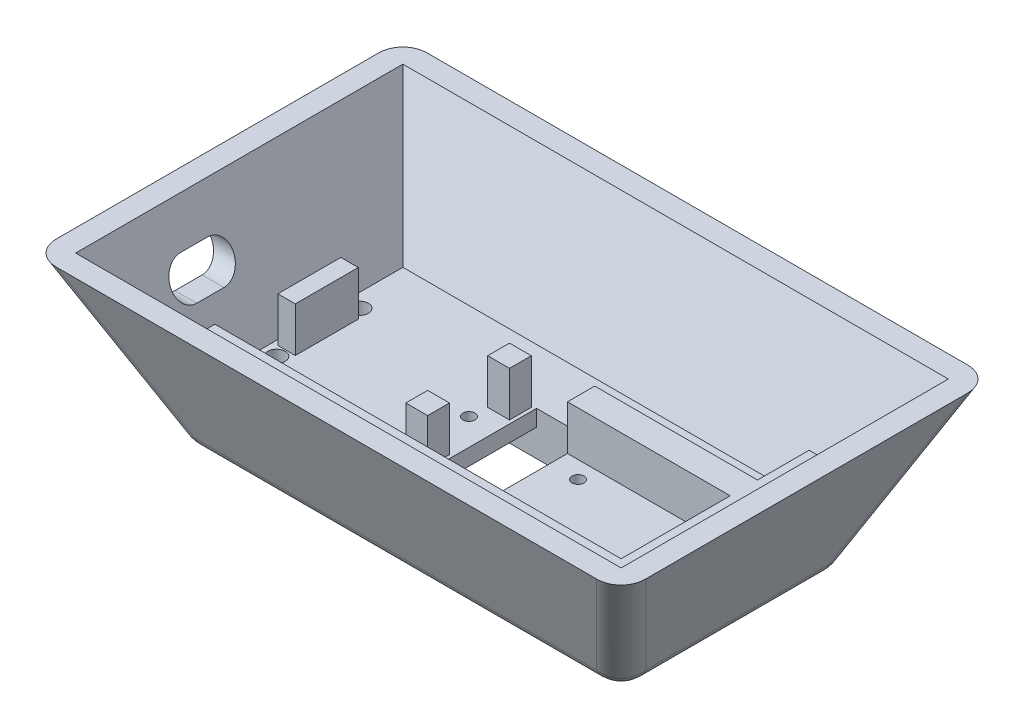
SolidWorks part; units mm, degrees
ref_plane "Front Plane" through (0, 0, 0) normal (0, 0, 1) x (1, 0, 0)
ref_plane "Top Plane" through (0, 0, 0) normal (0, 1, 0) x (1, 0, 0)
ref_plane "Right Plane" through (0, 0, 0) normal (1, 0, 0) x (0, 0, -1)
sketch "Sketch1" plane through (0, 0, 0) normal (0, 1, 0) x (1, 0, 0)
  line L1 (-40, 20) -> (40, 20)
  line L2 (-40, 20) -> (-40, -20)
  line L3 (-40, -20) -> (40, -20)
  line L4 (40, 20) -> (40, -20)
  line L5 (-40, 20) -> (40, -20) construction
  line L6 (-40, -20) -> (40, 20) construction
  point P0 (0, 0)
  dimension "D1" = 40
  dimension "D2" = 80
extrude "Boss-Extrude1" add sketch "Sketch1" along normal blind 30 draft 25
sketch "Sketch2" plane through (0, 0, 0) normal (0, -1, 0) x (1, 0, 0)
  line L0 (0, 9.6) -> (0, 20) construction
  line L1 (-15.1, 9.6) -> (15.1, 9.6)
  line L2 (-15.1, 9.6) -> (-15.1, -9.6)
  line L3 (-15.1, -9.6) -> (15.1, -9.6)
  line L4 (15.1, 9.6) -> (15.1, -9.6)
  line L5 (-15.1, 9.6) -> (15.1, -9.6) construction
  line L6 (-15.1, -9.6) -> (15.1, 9.6) construction
  line L7 (-40, 20) -> (40, 20) construction
  point P0 (0, 0)
  dimension "D1" = 19.2
  dimension "D2" = 30.2
  dimension "D3" = 10.4
extrude "Cut-Extrude1" cut sketch "Sketch2" against normal blind 5
sketch "Sketch3" plane through (0, 30, 0) normal (0, 1, 0) x (1, 0, 0)
  line L17 (-49.9892, 29.9892) -> (-49.9892, -29.9892)
  line L18 (-49.9892, -29.9892) -> (49.9892, -29.9892)
  line L19 (49.9892, -29.9892) -> (49.9892, 29.9892)
  line L20 (49.9892, 29.9892) -> (-49.9892, 29.9892)
  line L21 (-49.9892, 29.9892) -> (-49.9892, -29.9892)
  line L22 (-49.9892, -29.9892) -> (49.9892, -29.9892)
  line L23 (49.9892, -29.9892) -> (49.9892, 29.9892)
  line L24 (49.9892, 29.9892) -> (-49.9892, 29.9892)
  dimension "D2" = 4
extrude "Cut-Extrude3" cut sketch "Sketch3" against normal blind 22 draft 25
sketch "Sketch5" plane through (0, 5, 0) normal (0, -1, 0) x (1, 0, 0)
  line L0 (0, -2.1) -> (-10, -2.1) construction
  line L1 (0, -2.1) -> (10, -2.1) construction
  line L2 (-5.1, 5.6) -> (-5.1, 9.6) construction
  line L3 (15.1, 9.6) -> (-15.1, 9.6) construction
  line L4 (-5.1, 9.6) -> (4.9, 9.6) construction
  line L5 (-15.1, 9.6) -> (-15.1, -9.6) construction
  line L6 (4.9, 9.6) -> (-5.1, 9.6)
  line L7 (4.9, 9.6) -> (4.9, -9.6)
  line L8 (4.9, -9.6) -> (-5.1, -9.6)
  line L9 (-5.1, 9.6) -> (-5.1, -9.6)
  line L11 (-15.1, -9.6) -> (15.1, -9.6) construction
  circle A0 centre (-10, -2.1) radius 1.1
  circle A1 centre (10, -2.1) radius 1.1
  dimension "D3" = 2.2
  dimension "D4" = 2.2
  dimension "D1" = 10
  dimension "D2" = 10
  dimension "D5" = 4
  dimension "D6" = 10
  dimension "D7" = 7.5
  dimension "D9" = 10
extrude "Cut-Extrude4" cut sketch "Sketch5" against normal up to next
sketch "Sketch6" plane through (0, 8, 0) normal (0, 1, 0) x (1, 0, 0)
  line L0 (-5.1, 0) -> (-39.7305, 0) construction
  line L1 (-5.1, -9.6) -> (-5.1, 9.6) construction
  line L2 (-39.7305, 19.7305) -> (-39.7305, -19.7305) construction
  line L3 (-39.7305, 0) -> (-39.7305, -8.7) construction
  line L4 (-39.7305, -8.7) -> (-1.7305, -8.7) construction
  line L5 (-39.7305, 0) -> (-39.7305, 12.3) construction
  line L6 (-39.7305, -8.7) -> (-39.7305, -5.98) construction
  line L7 (-39.7305, 12.3) -> (-1.7305, 12.3)
  line L8 (-39.7305, 12.3) -> (-39.7305, -8.7)
  line L9 (-39.7305, -8.7) -> (-1.7305, -8.7)
  line L10 (-1.7305, 12.3) -> (-1.7305, -8.7)
  line L11 (-39.7305, -5.98) -> (-37.1905, -5.98) construction
  line L12 (-39.7305, -8.7) -> (-39.7305, 9.27) construction
  line L13 (-39.7305, 9.27) -> (-37.1905, 9.27) construction
  line L14 (-39.7305, -5.98) -> (-3.7305, -5.98) construction
  circle A0 centre (-37.1905, -5.98) radius 1.6
  circle A1 centre (-37.1905, 9.27) radius 1.6
  dimension "D2" = 3.2
extrude "PCB_HeatSetInserts" cut sketch "Sketch6" against normal blind 4.75
sketch "Sketch7" plane through (0, 8, 0) normal (0, 1, 0) x (1, 0, 0)
  line L0 (-9.7305, -5.7305) -> (-5.7305, -5.7305)
  line L1 (-38.7905, 9.27) -> (-38.7905, -5.98) construction
  line L2 (-35.5905, 9.27) -> (-35.5905, -5.98) construction
  line L3 (-37.1905, 7.67) -> (-37.1905, 6.92) construction
  line L4 (-37.1905, -4.38) -> (-37.1905, -4.13) construction
  line L5 (-9.7305, -5.7305) -> (-9.7305, -9.7305)
  line L6 (-38.7905, 7.42) -> (-35.5905, 7.42)
  line L7 (-38.7905, 7.42) -> (-38.7905, -4.13)
  line L8 (-38.7905, -4.13) -> (-35.5905, -4.13)
  line L9 (-35.5905, 7.42) -> (-35.5905, -4.13)
  line L10 (-9.7305, 9.2695) -> (-5.7305, 9.2695)
  line L11 (-9.7305, 9.2695) -> (-9.7305, 5.2695)
  line L12 (-9.7305, 5.2695) -> (-5.7305, 5.2695)
  line L13 (-5.7305, 9.2695) -> (-5.7305, 5.2695)
  line L14 (-9.7305, -9.7305) -> (-5.7305, -9.7305)
  line L15 (-5.7305, -5.7305) -> (-5.7305, -9.7305)
  line L16 (-37.1905, -5.98) -> (-39.7305, -5.98) construction
  line L17 (-37.1905, -5.98) -> (-37.1905, -8.7) construction
  line L18 (-39.7305, 19.7305) -> (-39.7305, -19.7305) construction
  line L19 (-39.7305, -8.7) -> (-9.7305, -8.7) construction
  line L20 (-9.7305, -8.7) -> (-9.7305, -7.7) construction
  line L21 (-9.7305, -5.7305) -> (-9.7305, 5.2695) construction
  line L22 (-39.7305, -19.7305) -> (-39.7305, -14.7305)
  line L23 (-39.7305, -14.7305) -> (34.7305, -14.7305)
  line L24 (34.7305, -14.7305) -> (34.7305, 5.2695)
  line L25 (34.7305, 5.2695) -> (4.9, 5.2695)
  line L26 (4.9, 9.6) -> (4.9, -9.6) construction
  line L27 (4.9, 5.2695) -> (4.9, 10.2695)
  line L28 (4.9, 10.2695) -> (34.7305, 10.2695)
  line L29 (34.7305, 10.2695) -> (34.7305, 19.7305)
  line L30 (39.7305, 19.7305) -> (-39.7305, 19.7305) construction
  line L31 (34.7305, 19.7305) -> (39.7305, 19.7305)
  line L32 (39.7305, 19.7305) -> (39.7305, -19.7305)
  line L33 (39.7305, -19.7305) -> (-39.7305, -19.7305)
  circle A0 centre (-37.1905, 9.27) radius 1.6 construction
  circle A1 centre (-37.1905, 9.27) radius 1.6 construction
  circle A2 centre (-37.1905, -5.98) radius 1.6 construction
  circle A3 centre (-37.1905, -5.98) radius 1.6 construction
  point P31 (-39.7305, -8.7)
  dimension "D1" = 0.75
  dimension "D2" = 2.54
  dimension "D3" = 2.72
  dimension "D4" = 30
  dimension "D5" = 4
  dimension "D6" = 4
  dimension "D7" = 4
  dimension "D8" = 4
  dimension "D9" = 11
  dimension "D10" = 1
  dimension "D11" = 5
  dimension "D12" = 5
  dimension "D13" = 20
  dimension "D14" = 5
extrude "Boss-Extrude3" add sketch "Sketch7" along normal blind 8.2
sketch "Sketch10" plane through (-35.5905, 0, 0) normal (1, 0, 0) x (0, 0, -1)
  line L0 (1.645, 8) -> (1.645, 20.25) construction
  line L1 (1.645, 20.25) -> (-17.105, 20.25) construction
  line L2 (-13.855, 20.25) -> (-8.855, 20.25) construction
  line L3 (-13.855, 23.5) -> (-8.855, 23.5)
  line L4 (-13.855, 17) -> (-8.855, 17)
  line L5 (1.645, 20.25) -> (-11.355, 20.25) construction
  line L6 (-4.13, 8) -> (7.42, 8) construction
  arc A0 (-13.855, 23.5) -> (-13.855, 17) centre (-13.855, 20.25) ccw
  arc A1 (-8.855, 17) -> (-8.855, 23.5) centre (-8.855, 20.25) ccw
  point P6 (-11.355, 20.25)
  point P13 (0, 0)
  point P14 (0, 0)
  dimension "D1" = 12.25
  dimension "D3" = 5
  dimension "D2" = 18.75
  dimension "D4" = 6.5
extrude "USB-C Cutout" cut sketch "Sketch10" against normal up to next contours L4 A1 L3 A0
fillet "Fillet1" radius 5 8 edges at (-40, 0, 0) (0, 0, 20) (40, 0, 0) (0, 0, -20) (-46.9946, 15, 26.9946) (46.9946, 15, 26.9946) (46.9946, 15, -26.9946) (-46.9946, 15, -26.9946)
